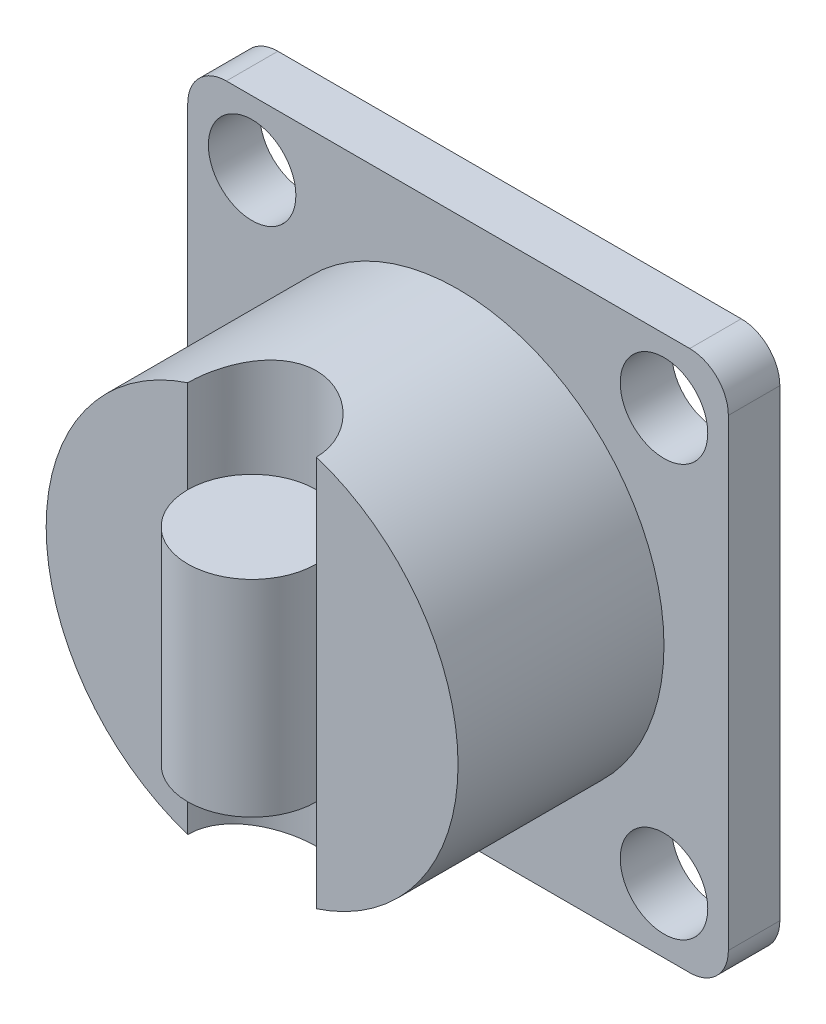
SolidWorks part; units mm, degrees
ref_plane "Plan de face" through (0, 0, 0) normal (0, 0, 1) x (1, 0, 0)
ref_plane "Plan de dessus" through (0, 0, 0) normal (0, 1, 0) x (1, 0, 0)
ref_plane "Plan de droite" through (0, 0, 0) normal (1, 0, 0) x (0, 0, -1)
sketch "Esquisse1" plane through (0, 0, 0) normal (0, 0, 1) x (1, 0, 0)
  line L1 (-21, 21) -> (0, 21)
  line L2 (-21, 21) -> (-21, 0)
  line L3 (-21, 0) -> (0, 0)
  line L4 (0, 21) -> (0, 0)
  dimension "D1" = 21
  dimension "D2" = 21
extrude "Extrusion1" add sketch "Esquisse1" along normal blind 2
sketch "Esquisse2" plane through (0, 0, 2) normal (0, 0, 1) x (1, 0, 0)
  line L0 (-21, 21) -> (-21, 0) construction
  line L1 (0, 21) -> (-21, 21) construction
  circle A0 centre (-10.5, 10.5) radius 8
  point P4 (-10.5, 21)
  dimension "D3" = 16
  dimension "D1" = 10.5
  dimension "D2" = 10.5
extrude "Extrusion2" add sketch "Esquisse2" along normal blind 8
sketch "Esquisse3" plane through (0, 21, 0) normal (0, 1, 0) x (-1, 0, 0)
  line L0 (18.5, 10) -> (2.5, 10) construction
  line L1 (0, 2) -> (0, 0) construction
  circle A0 centre (10.5, 10) radius 2.5
  dimension "D2" = 5
  dimension "D1" = 10.5
extrude "Enlèv. mat.-Extru.1" cut sketch "Esquisse3" against normal through all
ref_plane "Plan1" through (0, 10.5, 0) normal (0, 1, 0) x (-1, 0, 0)
sketch "Esquisse4" plane through (0, 10.5, 0) normal (0, 1, 0) x (-1, 0, 0)
  circle A0 centre (10.5, 10) radius 2.5
  arc A1 (8, 10) -> (13, 10) centre (10.5, 10) ccw construction
extrude "Extrusion3" add sketch "Esquisse4" along normal mid plane 8
hole_wizard "Dégagement M31" positions "Esquisse6" profile "Esquisse5" hole size "M3" standard "ISO"
sketch "Esquisse6" plane through (0, 0, 2) normal (0, 0, 1) x (1, 0, 0)
  line L0 (0, 0) -> (0, 21) construction
  line L1 (0, 21) -> (-21, 21) construction
  point P0 (-2.5, 18.5)
  dimension "D1" = 2.5
  dimension "D2" = 2.5
sketch "Esquisse5" plane through (-2.5, 18.5, 2) normal (1, 0, 0) x (0, -1, 0)
  line L0 (0, 0) -> (0, 2)
  line L1 (0, 2) -> (1.7, 2)
  line L2 (1.7, 2) -> (1.7, 0)
  line L5 (1.7, 0) -> (0, 0)
  line L11 (0, -6.35) -> (0, 107.95) construction
  dimension "Diamètre du perçage jusqu'au prochain" = 3.4
  dimension "Profondeur du perçage jusqu'au prochain" = 2
pattern_linear "Répétition linéaire1" count 2 spacing 16 along (0, -1, 0) count 2 spacing 16 along (-1, 0, 0) of "Dégagement M31"
fillet "Congé1" radius 1.5 4 edges at (-21, 21, 1) (0, 21, 1) (0, 0, 1) (-21, 0, 1)
